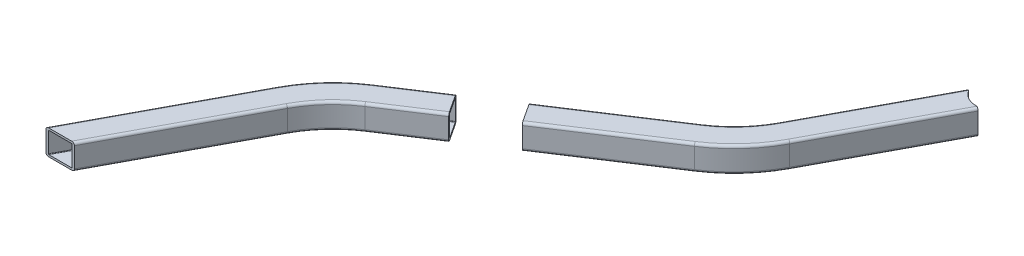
SolidWorks part; units mm, degrees
ref_plane "Plan de face" through (0, 0, 0) normal (0, 0, 1) x (1, 0, 0)
ref_plane "Plan de dessus" through (0, 0, 0) normal (0, 1, 0) x (1, 0, 0)
ref_plane "Plan de droite" through (0, 0, 0) normal (1, 0, 0) x (0, 0, -1)
sketch "Esquisse1" plane through (0, 0, 0) normal (0, 1, 0) x (1, 0, 0)
  line L0 (0, 263.6045) -> (0, -236.3955) construction
  line L1 (-205, -236.3955) -> (240, -236.3955) construction
  line L2 (-205, -236.3955) -> (-205, 263.6045) construction
  line L3 (-205, 263.6045) -> (240, 263.6045) construction
  line L4 (240, -236.3955) -> (240, 263.6045) construction
  line L5 (-205, 0) -> (240, 0) construction
  line L6 (-113.7818, -92.3973) -> (-193.9783, -242.2923)
  line L7 (-72.6193, -47.461) -> (125.8523, 82.252)
  line L8 (167.0148, 127.1882) -> (240, 263.6045)
  line L9 (-205, -236.3955) -> (-193.9783, -242.2923) construction
  line L10 (-113.7818, -92.3973) -> (-98.9454, -64.6667) construction
  line L11 (-72.6193, -47.461) -> (-98.9454, -64.6667) construction
  line L12 (167.0148, 127.1882) -> (152.1784, 99.4577) construction
  line L13 (125.8523, 82.252) -> (152.1784, 99.4577) construction
  arc A0 (-113.7818, -92.3973) -> (-72.6193, -47.461) centre (-5.3283, -150.4218) cw
  arc A1 (125.8523, 82.252) -> (167.0148, 127.1882) centre (58.5613, 185.2128) ccw
  dimension "D4" = 123
  dimension "D5" = 123
  dimension "D8" = 300
  dimension "D1" = 500
  dimension "D2" = 445
  dimension "D3" = 205
  dimension "D6" = 12.5
  dimension "D7" = 170
  dimension "D9" = 144
ref_plane "Plan1" through (-193.9783, 0, 242.2923) normal (-0.4717, 0, 0.8817) x (0.8817, 0, 0.4717)
sketch "Esquisse2" plane through (-193.9783, 0, 242.2923) normal (-0.4717, 0, 0.8817) x (0.8817, 0, 0.4717)
  line L0 (-10, 10.5) -> (10, 10.5)
  line L1 (-10, 12.5) -> (10, 12.5)
  line L2 (-12.5, 10) -> (-12.5, -10)
  line L3 (-10, -12.5) -> (10, -12.5)
  line L4 (12.5, 10) -> (12.5, -10)
  line L5 (-12.5, 12.5) -> (12.5, -12.5) construction
  line L6 (-12.5, -12.5) -> (12.5, 12.5) construction
  line L7 (10.5, 10) -> (10.5, -10)
  line L8 (-10, -10.5) -> (10, -10.5)
  line L9 (-10.5, 10) -> (-10.5, -10)
  arc A0 (-12.5, -10) -> (-10, -12.5) centre (-10, -10) ccw
  arc A1 (10, -12.5) -> (12.5, -10) centre (10, -10) ccw
  arc A2 (10, 12.5) -> (12.5, 10) centre (10, 10) cw
  arc A3 (-10, 12.5) -> (-12.5, 10) centre (-10, 10) ccw
  arc A4 (10, 10.5) -> (10.5, 10) centre (10, 10) cw
  arc A5 (10, -10.5) -> (10.5, -10) centre (10, -10) ccw
  arc A6 (-10.5, -10) -> (-10, -10.5) centre (-10, -10) ccw
  arc A7 (-10, 10.5) -> (-10.5, 10) centre (-10, 10) ccw
  point P0 (0, 0)
  dimension "D2" = 2.5
  dimension "D1" = 25
  dimension "D3" = 2
sweep "Balayage1" add profiles "Esquisse2" path "Esquisse1"
sketch "Esquisse3" plane through (0, 0, 0) normal (0, 1, 0) x (1, 0, 0)
  line L0 (-205, -236.3955) -> (-176.6468, -236.3955)
  line L1 (-205, -236.3955) -> (240, -236.3955) construction
  line L2 (-102.7601, -98.2941) -> (-182.9566, -248.1891) construction
extrude "Enlèv. mat.-Extru.1" cut sketch "Esquisse3" against normal through all and the other way through all flip side to cut
sketch "Esquisse4" plane through (0, 0, 0) normal (0, 1, 0) x (1, 0, 0)
  circle A0 centre (240, 263.6045) radius 19
  dimension "D1" = 38
extrude "Enlèv. mat.-Extru.2" cut sketch "Esquisse4" against normal through all and the other way through all
sketch "Esquisse5" plane through (0, 0, 0) normal (0, 1, 0) x (1, 0, 0)
  line L0 (221.357, 255.2565) -> (243.4004, 243.4629)
  line L1 (155.9931, 133.085) -> (222.2281, 256.8845) construction
  line L2 (178.0365, 121.2914) -> (244.2715, 245.0909) construction
  line L3 (167.0148, 127.1882) -> (240, 263.6045) construction
extrude "Enlèv. mat.-Extru.3" cut sketch "Esquisse5" against normal through all and the other way through all
sketch "Esquisse6" plane through (0, 0, 0) normal (0, 1, 0) x (1, 0, 0)
  circle A0 centre (0, 0) radius 3
  dimension "D1" = 6
extrude "Enlèv. mat.-Extru.4" cut sketch "Esquisse6" against normal through all and the other way through all
sketch "Esquisse7" plane through (0, 12.5, 0) normal (0, 1, 0) x (1, 0, 0)
  line L0 (-15.3441, -24.9611) -> (29.0211, 4.0342)
  line L1 (-15.3441, -24.9611) -> (-29.0211, -4.0342)
  line L2 (29.0211, 4.0342) -> (15.3441, 24.9611)
  line L3 (-29.0211, -4.0342) -> (15.3441, 24.9611)
  line L4 (-65.7808, -57.9245) -> (132.6908, 71.7885) construction
  line L6 (-79.4578, -36.9975) -> (119.0138, 92.7155) construction
  line L7 (0, 0) -> (-28.1937, 43.1387) construction
  dimension "D1" = 53
extrude "Enlèv. mat.-Extru.5" cut sketch "Esquisse7" against normal through all
